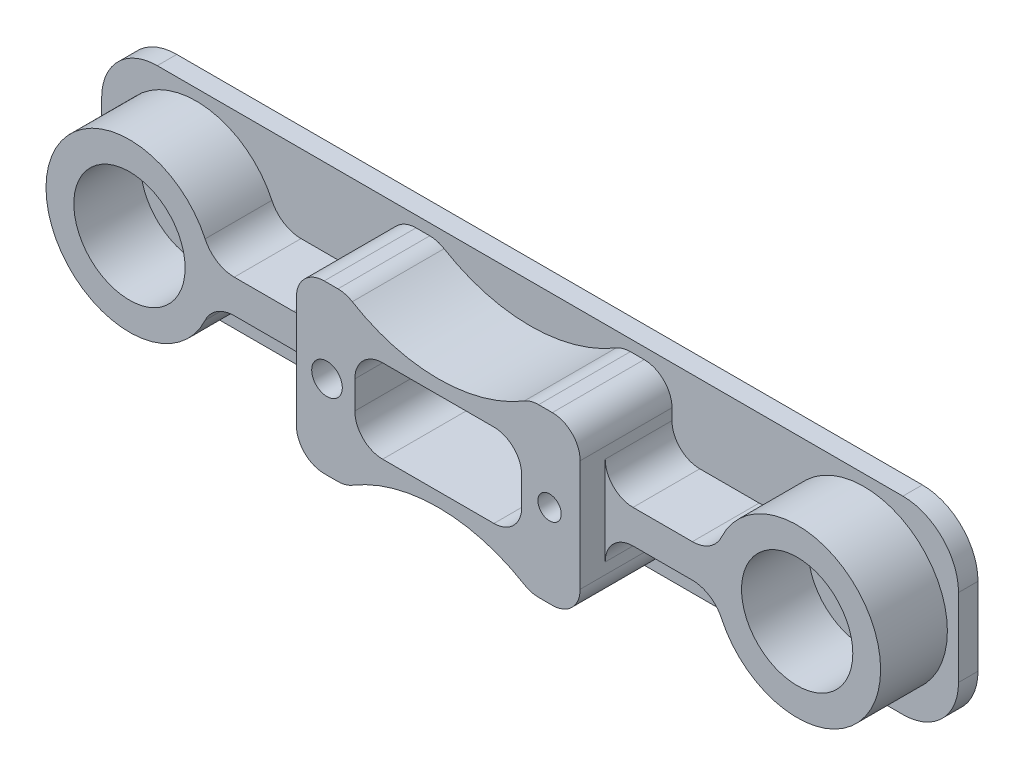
SolidWorks part; units mm, degrees
ref_plane "Ebene vorne" through (0, 0, 0) normal (0, 0, 1) x (1, 0, 0)
ref_plane "Ebene oben" through (0, 0, 0) normal (0, 1, 0) x (1, 0, 0)
ref_plane "Ebene rechts" through (0, 0, 0) normal (1, 0, 0) x (0, 0, -1)
sketch "Skizze1" plane through (0, 0, 0) normal (0, 0, 1) x (1, 0, 0)
  line L1 (-67, 17) -> (67, 17)
  line L2 (-77, 7) -> (-77, -7)
  line L3 (-67, -17) -> (67, -17)
  line L4 (77, 7) -> (77, -7)
  line L5 (-77, 17) -> (77, -17) construction
  line L6 (-77, -17) -> (77, 17) construction
  arc A0 (67, 17) -> (77, 7) centre (67, 7) cw
  arc A1 (77, -7) -> (67, -17) centre (67, -7) cw
  arc A2 (-77, -7) -> (-67, -17) centre (-67, -7) ccw
  arc A3 (-67, 17) -> (-77, 7) centre (-67, 7) ccw
  point P0 (0, 0)
  dimension "D3" = 10
  dimension "D1" = 154
  dimension "D2" = 34
extrude "Aufsatz-Linear austragen1" add sketch "Skizze1" along normal blind 3.5
sketch "Skizze2" plane through (0, 0, 3.5) normal (0, 0, 1) x (1, 0, 0)
  line L0 (0, 17) -> (0, -17) construction
  line L1 (67, 17) -> (-67, 17) construction
  line L2 (-67, -17) -> (67, -17) construction
  line L3 (-77, 0) -> (77, 0) construction
  line L4 (-77, 7) -> (-77, -7) construction
  line L5 (77, -7) -> (77, 7) construction
  line L6 (41.1658, 3) -> (-41.1658, 3)
  line L7 (41.1658, -3) -> (-41.1658, -3)
  arc A0 (-46.4048, -6.3379) -> (-46.4048, 6.3379) centre (-60, 0) cw
  arc A1 (-46.4048, 6.3379) -> (-41.1658, 3) centre (-41.1658, 8.7803) ccw
  arc A2 (-46.4048, -6.3379) -> (-41.1658, -3) centre (-41.1658, -8.7803) cw
  arc A3 (46.4048, -6.3379) -> (41.1658, -3) centre (41.1658, -8.7803) ccw
  arc A4 (46.4048, 6.3379) -> (41.1658, 3) centre (41.1658, 8.7803) cw
  arc A5 (46.4048, -6.3379) -> (46.4048, 6.3379) centre (60, 0) ccw
  point P13 (0, 3)
  point P28 (0, -3)
  dimension "D1" = 15
  dimension "D2" = 120
  dimension "D3" = 6
extrude "Aufsatz-Linear austragen2" add sketch "Skizze2" along normal blind 12
sketch "Skizze3" plane through (0, 0, 15.5) normal (0, 0, 1) x (1, 0, 0)
  circle A0 centre (-60, 0) radius 10
  circle A1 centre (60, 0) radius 10
extrude "Schnitt-Linear austragen1" cut sketch "Skizze3" against normal up to surface (12 mm away)
sketch "Skizze4" plane through (0, 0, 3.5) normal (0, 0, 1) x (1, 0, 0)
  line L1 (-20.5, 15) -> (20.5, 15)
  line L2 (-25.5, 10) -> (-25.5, -10)
  line L3 (-20.5, -15) -> (20.5, -15)
  line L4 (25.5, 10) -> (25.5, -10)
  line L5 (-25.5, 15) -> (25.5, -15) construction
  line L6 (-25.5, -15) -> (25.5, 15) construction
  arc A0 (-25.5, -10) -> (-20.5, -15) centre (-20.5, -10) ccw
  arc A1 (20.5, -15) -> (25.5, -10) centre (20.5, -10) ccw
  arc A2 (25.5, 10) -> (20.5, 15) centre (20.5, 10) ccw
  arc A3 (-20.5, 15) -> (-25.5, 10) centre (-20.5, 10) ccw
  point P0 (0, 0)
  dimension "D3" = 5
  dimension "D1" = 51
  dimension "D2" = 30
extrude "Aufsatz-Linear austragen3" add sketch "Skizze4" along normal blind 16.5
sketch "Skizze5" plane through (0, 0, 20) normal (0, 0, 1) x (1, 0, 0)
  line L1 (-10, 7.5) -> (10, 7.5)
  line L2 (-15, 2.5) -> (-15, -2.5)
  line L3 (-10, -7.5) -> (10, -7.5)
  line L4 (15, 2.5) -> (15, -2.5)
  line L5 (-15, 7.5) -> (15, -7.5) construction
  line L6 (-15, -7.5) -> (15, 7.5) construction
  arc A0 (-15, -2.5) -> (-10, -7.5) centre (-10, -2.5) ccw
  arc A1 (10, -7.5) -> (15, -2.5) centre (10, -2.5) ccw
  arc A2 (15, 2.5) -> (10, 7.5) centre (10, 2.5) ccw
  arc A3 (-10, 7.5) -> (-15, 2.5) centre (-10, 2.5) ccw
  point P0 (0, 0)
  dimension "D3" = 5
  dimension "D1" = 30
  dimension "D2" = 15
extrude "Schnitt-Linear austragen2" cut sketch "Skizze5" against normal up to surface (16.5 mm away)
hole_wizard "M5 Gewindebohrung1" positions "Skizze7" profile "Skizze6" tap size "M5" standard "DIN"
sketch "Skizze7" plane through (0, 0, 20) normal (0, 0, 1) x (1, 0, 0)
  line L0 (0, -15) -> (0, 17.6491) construction
  line L1 (-20.5, -15) -> (20.5, -15) construction
  point P0 (20, 0)
  dimension "D1" = 20
sketch "Skizze6" plane through (20, 0, 20) normal (1, 0, 0) x (0, -1, 0)
  line L0 (0, 0) -> (0, 18.2618)
  line L1 (0, 18.2618) -> (2.1, 17)
  line L2 (2.1, 17) -> (2.1, 0)
  line L5 (2.1, 0) -> (0, 0)
  line L10 (0, 18.2618) -> (-2.1, 17) construction
  line L11 (0, -6.35) -> (0, 107.95) construction
  dimension "Bohrerdurchmesser" = 4.2
  dimension "Bohrungstiefe" = 17
  dimension "Spitzenwinkel" = 118
hole_wizard "Kernloch für M61" positions "Skizze9" profile "Skizze8" hole size "M6" standard "DIN"
sketch "Skizze9" plane through (0, 0, 0) normal (0, 0, -1) x (-1, 0, 0)
  line L0 (0, -17) -> (0, 26.9066) construction
  line L1 (67, -17) -> (-67, -17) construction
  point P0 (20, 0)
  dimension "D1" = 20
sketch "Skizze8" plane through (-20, 0, 0) normal (1, 0, 0) x (0, 1, 0)
  line L0 (0, 0) -> (0, 5.7)
  line L1 (0, 5.7) -> (5.2, 0.5)
  line L2 (5.2, 0.5) -> (5.2, 0)
  line L5 (5.2, 0) -> (0, 0)
  line L10 (0, 5.7) -> (-5.2, 0.5) construction
  line L11 (0, -6.35) -> (0, 107.95) construction
  dimension "Bohrerdurchmesser" = 10.4
  dimension "Bohrungstiefe" = 0.5
  dimension "Spitzenwinkel" = 90
hole_wizard "Formsenkung für M5 Senkschraube mit Innensechskant1" positions "3D-Skizze1" profile "Skizze10" countersink size "M5" standard "DIN"
sketch3d "3D-Skizze1"
  line L0 (0, -17, 0) -> (0, 23.8759, 0) construction
  line L1 (-67, -17, 0) -> (67, -17, 0) construction
  line L3 (-77, 0, 0) -> (78.767, 0, 0) construction
  line L4 (-77, 7, 0) -> (-77, -7, 0) construction
  point P0 (-20, 0, 0)
  dimension "D1" = 20
sketch "Skizze10" plane through (-20, 0, 0) normal (1, 0, 0) x (0, 1, 0)
  line L0 (0, 0) -> (0, 20)
  line L1 (0, 20) -> (2.75, 20)
  line L2 (2.75, 20) -> (2.75, 2.45)
  line L3 (2.75, 2.45) -> (5.2, 0)
  line L5 (5.2, 0) -> (0, 0)
  line L6 (-2.75, 2.45) -> (-5.2, 0) construction
  line L11 (0, -6.35) -> (0, 107.95) construction
  dimension "Bohrerdurchmesser" = 5.5
  dimension "Bohrungstiefe" = 20
  dimension "Senkdurchmesser (Oben)" = 10.4
  dimension "Senkwinkel (Oben)" = 90
sketch "Skizze11" plane through (0, 0, 20) normal (0, 0, 1) x (1, 0, 0)
  line L0 (0, 15) -> (0, -17) construction
  line L1 (20.5, 15) -> (-20.5, 15) construction
  line L2 (-67, -17) -> (67, -17) construction
  line L3 (-25.5, 0) -> (25.5, 0) construction
  line L4 (-25.5, -3) -> (-25.5, 3) construction
  line L5 (25.5, 3) -> (25.5, -3) construction
  line L6 (20.5, 15) -> (-20.5, 15) construction
  line L7 (-16.5831, 15) -> (16.5831, 15)
  line L8 (16.5831, 15) -> (16.6534, 14.8627)
  line L9 (-16.5831, -15) -> (16.5831, -15)
  line L10 (-16.5831, -15) -> (16.5831, -15)
  arc A0 (16.5831, 15) -> (-16.5831, 15) centre (0, 40) cw
  arc A1 (16.5831, -15) -> (-16.5831, -15) centre (0, -40) ccw
  dimension "D1" = 40
  dimension "D2" = 30
extrude "Schnitt-Linear austragen3" cut sketch "Skizze11" against normal up to surface (16.5 mm away) contours A0 M18 | A1 M14
fillet "Verrundung1" radius 5 4 edges at (-16.5831, 15, 11.75) (16.5831, 15, 11.75) (16.5831, -15, 11.75) (-16.5831, -15, 11.75)
fillet "Verrundung2" radius 5 4 edges at (-25.5, -3, 9.5) (-25.5, 3, 9.5) (25.5, 3, 9.5) (25.5, -3, 9.5)
